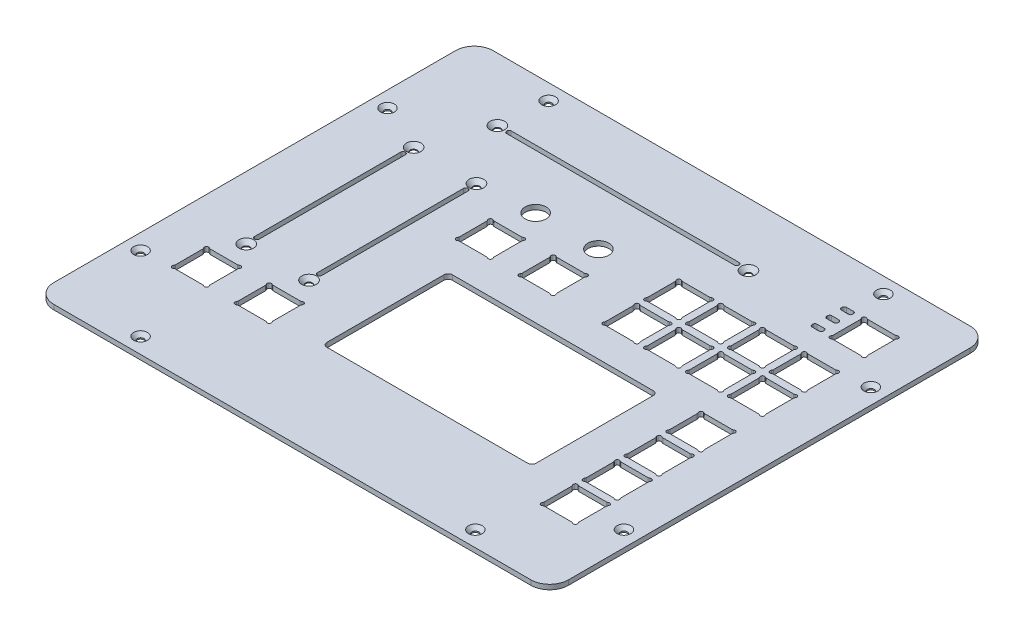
SolidWorks part; units mm, degrees
ref_plane "Alzado" through (0, 0, 0) normal (0, 0, 1) x (1, 0, 0)
ref_plane "Planta" through (0, 0, 0) normal (0, 1, 0) x (1, 0, 0)
ref_plane "Vista lateral" through (0, 0, 0) normal (1, 0, 0) x (0, 0, -1)
sketch "Croquis1" plane through (0, 0, 0) normal (0, 1, 0) x (1, 0, 0)
  line L0 (0, -1.1) -> (0, 1.1) construction
  line L1 (-55, 0) -> (55, 0) construction
  line L4 (125, -97) -> (125, 113)
  line L5 (125, -97) -> (-121, -97)
  line L6 (-121, -97) -> (-121, 113)
  line L7 (125, 113) -> (-121, 113)
  dimension "D1" = 210
  dimension "D2" = 246
  dimension "D4" = 125
  dimension "D8" = 113
extrude "Saliente-Extruir1" add sketch "Croquis1" along normal blind 2.3
sketch "Croquis5" plane through (0, 2.3, 0) normal (0, 1, 0) x (1, 0, 0)
  line L5 (125, 113) -> (-121, 113) construction
  line L6 (-121, 113) -> (-121, -97) construction
  line L7 (125, -97) -> (125, 113) construction
  line L8 (-121, -97) -> (125, -97) construction
  line L12 (109, 97) -> (-105, 97) construction
  line L13 (-105, 97) -> (-105, -81) construction
  line L14 (-105, -81) -> (109, -81) construction
  line L15 (109, -81) -> (109, 97) construction
  dimension "D1" = 16
  dimension "D2" = 16
  dimension "D3" = 16
  dimension "D4" = 16
fillet "Redondeo2" radius 9 4 edges at (125, 1.15, 97) (-121, 1.15, 97) (125, 1.15, -113) (-121, 1.15, -113)
sketch "Croquis3" plane through (0, 2.3, 0) normal (0, 1, 0) x (1, 0, 0)
  line L0 (-113.5, 8) -> (117.5, 8) construction
  line L1 (-110, 105.5) -> (-110, -89.5) construction
  line L2 (110, 105.5) -> (110, -89.5) construction
  line L3 (82, -89.5) -> (82, 105.5) construction
  line L4 (-121, 104) -> (-121, -88) construction
  line L5 (-78, 105.5) -> (-78, -89.5) construction
  line L7 (-110, -46.9118) -> (-78, -46.9118) construction
  line L8 (82, -46.9118) -> (110, -46.9118) construction
  line L9 (-112, -97) -> (116, -97) construction
  line L18 (0, 190.0033) -> (0, -241.867) construction
  line L23 (-113.5, 104) -> (-113.5, -88)
  line L24 (-112, -89.5) -> (116, -89.5)
  line L25 (117.5, -88) -> (117.5, 104)
  line L26 (116, 105.5) -> (-112, 105.5)
  line L27 (-113.5, 104) -> (-113.5, -88) construction
  line L28 (-112, -89.5) -> (116, -89.5) construction
  line L29 (117.5, -88) -> (117.5, 104) construction
  line L30 (116, 105.5) -> (-112, 105.5) construction
  circle A0 centre (-110, 105.5) radius 1.6 construction
  circle A1 centre (-78, 105.5) radius 1.6
  circle A2 centre (82, 105.5) radius 1.6
  circle A3 centre (110, 105.5) radius 1.6 construction
  circle A10 centre (117.5, 64) radius 1.6
  circle A11 centre (117.5, -54) radius 1.6
  circle A12 centre (-113.5, 64) radius 1.6
  circle A13 centre (-113.5, -54) radius 1.6
  arc A14 (116, -89.5) -> (117.5, -88) centre (116, -88) ccw
  arc A15 (116, -89.5) -> (117.5, -88) centre (116, -88) ccw construction
  arc A16 (117.5, 104) -> (116, 105.5) centre (116, 104) ccw
  arc A17 (117.5, 104) -> (116, 105.5) centre (116, 104) ccw construction
  arc A18 (-112, 105.5) -> (-113.5, 104) centre (-112, 104) ccw
  arc A19 (-112, 105.5) -> (-113.5, 104) centre (-112, 104) ccw construction
  arc A20 (-113.5, -88) -> (-112, -89.5) centre (-112, -88) ccw
  arc A21 (-113.5, -88) -> (-112, -89.5) centre (-112, -88) ccw construction
  circle A22 centre (-78, -89.5) radius 1.6
  circle A23 centre (82, -89.5) radius 1.6
  point P23 (0, 132.35)
  point P29 (0.4627, 121.1808)
  point P33 (-113.5, 8)
  point P54 (0, 132.35)
  dimension "D1" = 3.2
  dimension "D3" = 220
  dimension "D8" = 43
  dimension "D6" = 43
  dimension "D4" = 160
  dimension "D5" = 161
  dimension "D2" = 7.5
  dimension "D9" = 110
extrude "Cortar-Extruir1" cut sketch "Croquis3" against normal through all
chamfer "Chaflán1" distance 1.7 angle 45 8 edges at (-78, 2.3, 91.1) (117.5, 2.3, -62.4) (82, 2.3, -103.9) (-78, 2.3, -103.9) (117.5, 2.3, 55.6) (82, 2.3, 91.1) (-113.5, 2.3, 55.6) (-113.5, 2.3, -62.4)
sketch "Croquis6" plane through (0, 2.3, 0) normal (0, 1, 0) x (1, 0, 0)
  line L0 (-219.7186, 83) -> (49780.2814, 83) construction
  line L1 (116, 113) -> (-112, 113) construction
  line L2 (-75.5, 84.1) -> (35.5, 84.1)
  line L3 (-75.5, 84.1) -> (-75.5, 81.9)
  line L4 (-75.5, 81.9) -> (35.5, 81.9)
  line L5 (35.5, 84.1) -> (35.5, 81.9)
  line L7 (-91, 73.8475) -> (-91, -49926.1525) construction
  line L8 (-121, 104) -> (-121, -88) construction
  line L9 (-92.1, 50) -> (-89.9, 50)
  line L10 (-92.1, 50) -> (-92.1, -22)
  line L11 (-92.1, -22) -> (-89.9, -22)
  line L12 (-89.9, 50) -> (-89.9, -22)
  line L13 (116, 113) -> (-112, 113) construction
  line L14 (109, -81) -> (109, 97) construction
  circle A0 centre (40, 83) radius 1.6
  circle A1 centre (-80, 83) radius 1.6
  circle A2 centre (-91, -26) radius 1.6
  circle A3 centre (-91, 54) radius 1.6
  point P6 (-75.5, 83)
  point P22 (-91, -22)
  dimension "D4" = 3.2
  dimension "D5" = 120
  dimension "D9" = 3.2
  dimension "D14" = 69
  dimension "D1" = 2.2
  dimension "D2" = 30
  dimension "D3" = 111
  dimension "D6" = 4.5
  dimension "D7" = 2.2
  dimension "D8" = 72
  dimension "D10" = 80
  dimension "D11" = 4
  dimension "D12" = 30
  dimension "D13" = 59
extrude "Cortar-Extruir3" cut sketch "Croquis6" against normal through all
sketch "Croquis7" plane through (0, 2.3, 0) normal (0, 1, 0) x (1, 0, 0)
  line L0 (109, -81) -> (109, 97) construction
  line L13 (116, 113) -> (-112, 113) construction
  line L15 (-103.2, 83) -> (-144.8619, 83) construction
  line L16 (-91, 54) -> (-91, -26) construction
  line L17 (77.6, 81.8) -> (83, 81.8)
  line L18 (87, 91.3) -> (103.6, 91.3)
  line L19 (87, 91.3) -> (87, 74.7)
  line L20 (87, 74.7) -> (103.6, 74.7)
  line L21 (103.6, 91.3) -> (103.6, 74.7)
  line L22 (77.6, 91.2) -> (83, 91.2)
  line L23 (77.6, 91.2) -> (77.6, 88.8)
  line L24 (77.6, 88.8) -> (83, 88.8)
  line L25 (83, 91.2) -> (83, 88.8)
  line L26 (77.6, 77.2) -> (83, 77.2)
  line L27 (77.6, 77.2) -> (77.6, 74.8)
  line L28 (77.6, 74.8) -> (83, 74.8)
  line L29 (83, 77.2) -> (83, 74.8)
  line L30 (80.3, 91.2) -> (80.3, 74.8) construction
  line L31 (95.3, 91.3) -> (95.3, 74.7) construction
  line L32 (77.6, 81.8) -> (77.6, 84.2)
  line L33 (77.6, 84.2) -> (83, 84.2)
  line L34 (83, 81.8) -> (83, 84.2)
  line L35 (77.6, 81.8) -> (83, 84.2) construction
  line L36 (77.6, 84.2) -> (83, 81.8) construction
  point P2 (95.3, 83)
  point P3 (80.3, 83)
  point P8 (95.3, 83)
  point P38 (80.3, 83)
  dimension "D2" = 15
  dimension "D3" = 5.4
  dimension "D4" = 2.4
  dimension "D6" = 30
  dimension "D9" = 16.6
  dimension "D10" = 16.6
  dimension "D11" = 5.4
  dimension "D13" = 16.4
  dimension "D14" = 2.4
  dimension "D15" = 2.4
extrude "Cortar-Extruir4" cut sketch "Croquis7" against normal through all
sketch "Croquis27" plane through (0, 2.3, 0) normal (0, 1, 0) x (1, 0, 0)
  line L0 (87, 91.3) -> (87, 74.7) construction
  line L1 (87.6, 75.3) -> (103, 75.3) construction
  line L2 (87.6, 75.3) -> (87.6, 90.7) construction
  line L3 (87.6, 90.7) -> (103, 90.7) construction
  line L4 (103, 75.3) -> (103, 90.7) construction
  line L5 (87.6, 75.3) -> (103, 90.7) construction
  line L6 (87.6, 90.7) -> (103, 75.3) construction
  line L7 (103.6, 91.3) -> (87, 91.3) construction
  line L8 (103.6, 74.7) -> (103.6, 91.3) construction
  line L9 (87, 74.7) -> (103.6, 74.7) construction
  circle A0 centre (103, 90.7) radius 1
  circle A1 centre (87.6, 90.7) radius 1
  circle A2 centre (87.6, 75.3) radius 1
  circle A3 centre (103, 75.3) radius 1
  point P0 (95.3, 83)
  dimension "D5" = 2
  dimension "D1" = 0.6
  dimension "D2" = 0.6
  dimension "D3" = 0.6
  dimension "D4" = 0.6
extrude "Cortar-Extruir20" cut sketch "Croquis27" against normal through all
fillet "Redondeo6" radius 1 8 edges at (103.6, 1.15, -76.1) (102.2, 1.15, -74.7) (88.4, 1.15, -74.7) (87, 1.15, -76.1) (87, 1.15, -89.9) (88.4, 1.15, -91.3) (103.6, 1.15, -89.9) (102.2, 1.15, -91.3)
sketch "Croquis14" plane through (0, 2.3, 0) normal (0, 1, 0) x (1, 0, 0)
  line L1 (-121, 104) -> (-121, -88) construction
  line L2 (-49, -73.3) -> (77, -73.3) construction
  line L3 (-49, -73.3) -> (-49, 23) construction
  line L4 (-49, 23) -> (77, 23) construction
  line L5 (77, -73.3) -> (77, 23) construction
  line L6 (-49, -73.3) -> (77, 23) construction
  line L7 (-49, 23) -> (77, -73.3) construction
  line L9 (116, 113) -> (-112, 113) construction
  point P4 (14, -25.15)
  dimension "D1" = 96.3
  dimension "D2" = 126
  dimension "D3" = 90
  dimension "D4" = 72
sketch "Croquis10" plane through (0, 2.3, 0) normal (0, 1, 0) x (1, 0, 0)
  line L0 (-112, -97) -> (116, -97) construction
  line L1 (-31, 10.5) -> (69, 10.5)
  line L2 (-31, 10.5) -> (-31, -49.5)
  line L3 (-31, -49.5) -> (69, -49.5)
  line L4 (69, 10.5) -> (69, -49.5)
  line L6 (-31, 10.5) -> (69, -49.5) construction
  line L7 (125, -88) -> (125, 104) construction
  point P7 (14, -25.15)
  dimension "D1" = 60
  dimension "D2" = 100
  dimension "D3" = 47.5
  dimension "D4" = 56
extrude "Cortar-Extruir7" cut sketch "Croquis10" against normal through all
fillet "Redondeo3" radius 2 4 edges at (-31, 1.15, 49.5) (69, 1.15, 49.5) (69, 1.15, -10.5) (-31, 1.15, -10.5)
pattern_linear "MatrizL5" count 2 spacing 30 along (1, 0, 0) of "Cortar-Extruir3"
sketch "Croquis18" plane through (0, 2.3, 0) normal (0, 1, 0) x (1, 0, 0)
  line L1 (-43, 42.7) -> (-26.4, 42.7)
  line L2 (-43, 42.7) -> (-43, 26.1)
  line L3 (-43, 26.1) -> (-26.4, 26.1)
  line L4 (-26.4, 42.7) -> (-26.4, 26.1)
  line L5 (-43, 42.7) -> (-26.4, 26.1) construction
  line L6 (-43, 26.1) -> (-26.4, 42.7) construction
  line L8 (-112, -97) -> (116, -97) construction
  line L9 (125, -88) -> (125, 104) construction
  point P0 (-34.7, 34.4)
  dimension "D1" = 16.6
  dimension "D2" = 16.6
  dimension "D3" = 131.4
  dimension "D4" = 159.7
extrude "Cortar-Extruir14" cut sketch "Croquis18" against normal through all
sketch "Croquis28" plane through (0, 2.3, 0) normal (0, 1, 0) x (1, 0, 0)
  line L0 (-43, 42.7) -> (-43, 26.1) construction
  line L1 (-42.4, 26.7) -> (-27, 26.7) construction
  line L2 (-42.4, 26.7) -> (-42.4, 42.1) construction
  line L3 (-42.4, 42.1) -> (-27, 42.1) construction
  line L4 (-27, 26.7) -> (-27, 42.1) construction
  line L5 (-42.4, 26.7) -> (-27, 42.1) construction
  line L6 (-42.4, 42.1) -> (-27, 26.7) construction
  line L7 (-26.4, 42.7) -> (-43, 42.7) construction
  line L8 (-26.4, 26.1) -> (-26.4, 42.7) construction
  circle A0 centre (-27, 42.1) radius 1
  circle A1 centre (-27, 26.7) radius 1
  circle A2 centre (-42.4, 26.7) radius 1
  circle A3 centre (-42.4, 42.1) radius 1
  point P0 (-34.7, 34.4)
  dimension "D4" = 2
  dimension "D1" = 0.6
  dimension "D2" = 0.6
  dimension "D3" = 0.6
extrude "Cortar-Extruir21" cut sketch "Croquis28" against normal through all
fillet "Redondeo7" radius 1 8 edges at (-43, 1.15, -27.5) (-41.6, 1.15, -26.1) (-27.8, 1.15, -26.1) (-26.4, 1.15, -27.5) (-26.4, 1.15, -41.3) (-27.8, 1.15, -42.7) (-43, 1.15, -41.3) (-41.6, 1.15, -42.7)
pattern_linear "MatrizL9" count 2 spacing 30 along (1, 0, 0) of "Cortar-Extruir14", "Cortar-Extruir21", "Redondeo7"
sketch "Croquis19" plane through (0, 2.3, 0) normal (0, 1, 0) x (1, 0, 0)
  line L1 (27, 42.7) -> (43.6, 42.7)
  line L2 (27, 42.7) -> (27, 26.1)
  line L3 (27, 26.1) -> (43.6, 26.1)
  line L4 (43.6, 42.7) -> (43.6, 26.1)
  line L5 (27, 42.7) -> (43.6, 26.1) construction
  line L6 (27, 26.1) -> (43.6, 42.7) construction
  line L48 (27, 62.7) -> (27, 46.1)
  line L49 (27, 62.7) -> (43.6, 62.7)
  line L50 (43.6, 62.7) -> (43.6, 46.1)
  line L51 (27, 46.1) -> (43.6, 46.1)
  line L52 (67, 42.7) -> (67, 26.1)
  line L53 (67, 42.7) -> (83.6, 42.7)
  line L54 (83.6, 42.7) -> (83.6, 26.1)
  line L55 (67, 26.1) -> (83.6, 26.1)
  line L56 (87, 42.7) -> (87, 26.1)
  line L57 (87, 42.7) -> (103.6, 42.7)
  line L58 (103.6, 42.7) -> (103.6, 26.1)
  line L59 (87, 26.1) -> (103.6, 26.1)
  line L60 (47, 42.7) -> (47, 26.1)
  line L61 (47, 42.7) -> (63.6, 42.7)
  line L62 (63.6, 42.7) -> (63.6, 26.1)
  line L63 (47, 26.1) -> (63.6, 26.1)
  line L64 (107, 42.7) -> (107, 26.1)
  line L65 (107, 42.7) -> (123.6, 42.7)
  line L66 (123.6, 42.7) -> (123.6, 26.1)
  line L67 (107, 26.1) -> (123.6, 26.1)
  line L68 (127, 42.7) -> (127, 26.1)
  line L69 (127, 42.7) -> (143.6, 42.7)
  line L70 (143.6, 42.7) -> (143.6, 26.1)
  line L71 (127, 26.1) -> (143.6, 26.1)
  line L72 (47, 62.7) -> (47, 46.1)
  line L73 (47, 62.7) -> (63.6, 62.7)
  line L74 (63.6, 62.7) -> (63.6, 46.1)
  line L75 (47, 46.1) -> (63.6, 46.1)
  line L76 (67, 62.7) -> (67, 46.1)
  line L77 (67, 62.7) -> (83.6, 62.7)
  line L78 (83.6, 62.7) -> (83.6, 46.1)
  line L79 (67, 46.1) -> (83.6, 46.1)
  line L80 (87, 62.7) -> (87, 46.1)
  line L81 (87, 62.7) -> (103.6, 62.7)
  line L82 (103.6, 62.7) -> (103.6, 46.1)
  line L83 (87, 46.1) -> (103.6, 46.1)
  line L84 (107, 62.7) -> (107, 46.1)
  line L85 (107, 62.7) -> (123.6, 62.7)
  line L86 (123.6, 62.7) -> (123.6, 46.1)
  line L87 (107, 46.1) -> (123.6, 46.1)
  line L88 (127, 62.7) -> (127, 46.1)
  line L89 (127, 62.7) -> (143.6, 62.7)
  line L90 (143.6, 62.7) -> (143.6, 46.1)
  line L91 (127, 46.1) -> (143.6, 46.1)
  line L92 (-1037.413, 34.4) -> (48962.587, 34.4) construction
  line L93 (-13, 40.9) -> (-13, 27.9) construction
  point P0 (35.3, 34.4)
  point P13 (-13, 34.4)
  dimension "D1" = 16.6
  dimension "D2" = 16.6
  dimension "D4" = 13
  dimension "D5" = 6
  dimension "D6" = 2
extrude "Botóns" cut sketch "Croquis19" against normal through all
sketch "Croquis29" plane through (0, 2.3, 0) normal (0, 1, 0) x (1, 0, 0)
  line L0 (43.6, 42.7) -> (27, 42.7) construction
  line L1 (27.6, 26.7) -> (43, 26.7) construction
  line L2 (27.6, 26.7) -> (27.6, 42.1) construction
  line L3 (27.6, 42.1) -> (43, 42.1) construction
  line L4 (43, 26.7) -> (43, 42.1) construction
  line L5 (27.6, 26.7) -> (43, 42.1) construction
  line L6 (27.6, 42.1) -> (43, 26.7) construction
  line L7 (27, 42.7) -> (27, 26.1) construction
  line L8 (27, 26.1) -> (43.6, 26.1) construction
  line L9 (43.6, 26.1) -> (43.6, 42.7) construction
  line L10 (43.6, 62.7) -> (27, 62.7) construction
  line L11 (27.6, 46.7) -> (43, 46.7) construction
  line L12 (27.6, 46.7) -> (27.6, 62.1) construction
  line L13 (27.6, 62.1) -> (43, 62.1) construction
  line L14 (43, 46.7) -> (43, 62.1) construction
  line L15 (27.6, 46.7) -> (43, 62.1) construction
  line L16 (27.6, 62.1) -> (43, 46.7) construction
  line L17 (27, 62.7) -> (27, 46.1) construction
  line L18 (43.6, 46.1) -> (43.6, 62.7) construction
  line L19 (27, 46.1) -> (43.6, 46.1) construction
  circle A0 centre (27.6, 42.1) radius 1
  circle A1 centre (43, 42.1) radius 1
  circle A2 centre (43, 26.7) radius 1
  circle A3 centre (27.6, 26.7) radius 1
  circle A4 centre (27.6, 62.1) radius 1
  circle A5 centre (43, 62.1) radius 1
  circle A6 centre (43, 46.7) radius 1
  circle A7 centre (27.6, 46.7) radius 1
  point P0 (35.3, 34.4)
  point P17 (35.3, 54.4)
  dimension "D5" = 2
  dimension "D10" = 2
  dimension "D1" = 0.6
  dimension "D2" = 0.6
  dimension "D3" = 0.6
  dimension "D4" = 0.6
  dimension "D6" = 0.6
  dimension "D7" = 0.6
  dimension "D8" = 0.6
  dimension "D9" = 0.6
extrude "Cortar-Extruir22" cut sketch "Croquis29" against normal through all
fillet "Redondeo8" radius 1 16 edges at (28.4, 1.15, -46.1) (42.2, 1.15, -46.1) (43.6, 1.15, -47.5) (43.6, 1.15, -61.3) (42.2, 1.15, -62.7) (28.4, 1.15, -62.7) (27, 1.15, -61.3) (27, 1.15, -47.5) (27, 1.15, -27.5) (28.4, 1.15, -26.1) (42.2, 1.15, -26.1) (43.6, 1.15, -27.5) (43.6, 1.15, -41.3) (42.2, 1.15, -42.7) (27, 1.15, -41.3) (28.4, 1.15, -42.7)
pattern_linear "MatrizL15" count 4 spacing 20 along (1, 0, 0) of "Botóns", "Cortar-Extruir22", "Redondeo8"
sketch "Croquis25" plane through (0, 2.3, 0) normal (0, 1, 0) x (1, 0, 0)
  line L0 (-34.7, -965.3) -> (-34.7, 49034.7) construction
  line L1 (-41.7, 63) -> (-27.7, 63)
  line L2 (-41.7, 63) -> (-41.7, 49)
  line L3 (-41.7, 49) -> (-27.7, 49)
  line L4 (-27.7, 63) -> (-27.7, 49)
  line L5 (-41.7, 63) -> (-27.7, 49) construction
  line L6 (-41.7, 49) -> (-27.7, 63) construction
  line L7 (-11.7, 63) -> (2.3, 63)
  line L8 (-11.7, 63) -> (-11.7, 49)
  line L9 (-11.7, 49) -> (2.3, 49)
  line L10 (2.3, 63) -> (2.3, 49)
  line L11 (-11.7, 63) -> (2.3, 49) construction
  line L12 (-11.7, 49) -> (2.3, 63) construction
  line L13 (-28.2, 42.7) -> (-41.2, 42.7) construction
  line L14 (-4.7, -965.3) -> (-4.7, 49034.7) construction
  line L15 (1.8, 42.7) -> (-11.2, 42.7) construction
  line L16 (-1059.213, 56) -> (48940.787, 56) construction
  line L18 (-91, 75.5) -> (61, 75.5) construction
  line L19 (-91, 75.5) -> (-91, 89.5) construction
  line L20 (-91, 89.5) -> (61, 89.5) construction
  line L21 (61, 75.5) -> (61, 89.5) construction
  line L22 (-91, 75.5) -> (61, 89.5) construction
  line L23 (-91, 89.5) -> (61, 75.5) construction
  line L25 (-67.5, -37) -> (-53.5, -37)
  line L27 (-67.5, -37) -> (-67.5, 75)
  line L28 (-67.5, 75) -> (-53.5, 75)
  line L29 (-53.5, -37) -> (-53.5, 75)
  line L30 (-67.5, -37) -> (-53.5, 75) construction
  line L31 (-67.5, 75) -> (-53.5, -37) construction
  line L32 (-97.5, -37) -> (-83.5, -37)
  line L33 (-97.5, -37) -> (-97.5, 75)
  line L34 (-97.5, 75) -> (-83.5, 75)
  line L35 (-83.5, -37) -> (-83.5, 75)
  line L36 (-97.5, -37) -> (-83.5, 75) construction
  line L37 (-97.5, 75) -> (-83.5, -37) construction
  line L38 (-92.1, 50) -> (-92.1, -22) construction
  line L39 (-75.5, 81.9) -> (35.5, 81.9) construction
  line L40 (35.5, 81.9) -> (35.5, 84.1) construction
  circle A0 centre (-80, 83) radius 1.6 construction
  circle A1 centre (-91, 54) radius 1.6 construction
  point P0 (-34.7, 56)
  point P5 (-4.7, 56)
  point P15 (-34.7, 42.7)
  point P20 (-4.7, 42.7)
  point P21 (-15, 82.5)
  point P29 (-60.5, 19)
  point P32 (35.5, 83)
  point P38 (-20, 81.9)
  point P40 (-90.5, 19)
  point P53 (-92.1, 14)
  dimension "D3" = 20
  dimension "D8" = 6.5
  dimension "D1" = 14
  dimension "D2" = 14
  dimension "D4" = 152
  dimension "D5" = 6.5
  dimension "D6" = 14
  dimension "D7" = 112
  dimension "D9" = 61
  dimension "D10" = 30
  dimension "D11" = 81
sketch "Croquis23" plane through (0, 2.3, 0) normal (0, 1, 0) x (1, 0, 0)
  circle A0 centre (-34.7, 56) radius 5
  circle A1 centre (-4.7, 56) radius 5
  dimension "D1" = 10
extrude "Cortar-Extruir19" cut sketch "Croquis23" against normal through all
chamfer "Chaflán2" distance 1.9 angle 45 6 edges at (-61, 2.3, 27.6) (-91, 2.3, 27.6) (-61, 2.3, -52.4) (-91, 2.3, -52.4) (40, 2.3, -81.4) (-80, 2.3, -81.4)
sketch "Croquis20" plane through (0, 2.3, 0) normal (0, 1, 0) x (1, 0, 0)
  line L0 (-91, 54) -> (-91, -26) construction
  line L1 (-99.3, -53.3) -> (-82.7, -53.3)
  line L2 (-99.3, -53.3) -> (-99.3, -36.7)
  line L3 (-99.3, -36.7) -> (-82.7, -36.7)
  line L4 (-82.7, -53.3) -> (-82.7, -36.7)
  line L5 (-99.3, -53.3) -> (-82.7, -36.7) construction
  line L6 (-99.3, -36.7) -> (-82.7, -53.3) construction
  circle A0 centre (-91, 54) radius 1.6 construction
  point P0 (-91, -45)
  dimension "D1" = 16.6
  dimension "D2" = 16.6
  dimension "D3" = 19
extrude "Cortar-Extruir16" cut sketch "Croquis20" against normal through all
sketch "Croquis30" plane through (0, 2.3, 0) normal (0, 1, 0) x (1, 0, 0)
  line L0 (-99.3, -36.7) -> (-99.3, -53.3) construction
  line L1 (-98.7, -52.7) -> (-83.3, -52.7) construction
  line L2 (-98.7, -52.7) -> (-98.7, -37.3) construction
  line L3 (-98.7, -37.3) -> (-83.3, -37.3) construction
  line L4 (-83.3, -52.7) -> (-83.3, -37.3) construction
  line L5 (-98.7, -52.7) -> (-83.3, -37.3) construction
  line L6 (-98.7, -37.3) -> (-83.3, -52.7) construction
  line L7 (-82.7, -53.3) -> (-82.7, -36.7) construction
  line L8 (-82.7, -36.7) -> (-99.3, -36.7) construction
  line L9 (-99.3, -53.3) -> (-82.7, -53.3) construction
  circle A0 centre (-98.7, -37.3) radius 1
  circle A1 centre (-83.3, -37.3) radius 1
  circle A2 centre (-83.3, -52.7) radius 1
  circle A3 centre (-98.7, -52.7) radius 1
  point P0 (-91, -45)
  dimension "D5" = 2
  dimension "D1" = 0.6
  dimension "D2" = 0.6
  dimension "D3" = 0.6
  dimension "D4" = 0.6
extrude "Cortar-Extruir23" cut sketch "Croquis30" against normal through all
fillet "Redondeo9" radius 1 8 edges at (-84.1, 1.15, 53.3) (-97.9, 1.15, 53.3) (-82.7, 1.15, 51.9) (-82.7, 1.15, 38.1) (-84.1, 1.15, 36.7) (-99.3, 1.15, 51.9) (-99.3, 1.15, 38.1) (-97.9, 1.15, 36.7)
pattern_linear "MatrizL12" count 2 spacing 30 along (1, 0, 0) of "Cortar-Extruir16", "Cortar-Extruir23", "Redondeo9"
sketch "Croquis21" plane through (0, 2.3, 0) normal (0, 1, 0) x (1, 0, 0)
  point P0 (-113.5, -54)
  point P1 (-91, -26)
  point P3 (-61, -26)
  point P5 (-78, -89.5)
  point P9 (-34.7, 56)
  point P10 (-4.7, 56)
  point P11 (-91, 54)
  point P12 (-34.8, 34.35)
  point P13 (-61, 54)
  point P15 (-4.8, 34.35)
  point P17 (80.3, 90)
  point P18 (80.3, 83)
  point P19 (-80, 83)
  point P20 (80.3, 76)
  point P21 (40, 83)
  point P23 (82, -89.5)
  point P25 (117.5, -54)
  point P27 (117.5, 64)
  point P29 (82, 105.5)
  point P35 (-78, 105.5)
  point P37 (-113.5, 64)
  point P39 (95.3, 83)
  point P43 (95.3, 54.35)
  point P44 (75.3, 54.35)
  point P45 (55.3, 54.35)
  point P46 (35.3, 54.35)
  point P47 (95.3, 34.35)
  point P48 (75.3, 34.35)
  point P49 (55.3, 34.35)
  point P50 (35.3, 34.35)
  point P51 (-61, -45)
  point P52 (-91, -45)
sketch "Croquis24" plane through (0, 2.3, 0) normal (0, 1, 0) x (1, 0, 0)
  line L0 (95.3, 61.75) -> (95.3, -79.6868) construction
  line L1 (87, -3.3) -> (103.6, -3.3)
  line L2 (87, -3.3) -> (87, 13.3)
  line L3 (87, 13.3) -> (103.6, 13.3)
  line L4 (103.6, -3.3) -> (103.6, 13.3)
  line L5 (87, -3.3) -> (103.6, 13.3) construction
  line L6 (87, 13.3) -> (103.6, -3.3) construction
  line L7 (-112, -97) -> (116, -97) construction
  line L8 (101.8, 62.7) -> (88.8, 62.7) construction
  point P0 (95.3, 5)
  point P10 (95.3, 62.7)
  dimension "D1" = 16.6
  dimension "D2" = 102
extrude "Cortar-Extruir18" cut sketch "Croquis24" against normal through all
sketch "Croquis31" plane through (0, 2.3, 0) normal (0, 1, 0) x (1, 0, 0)
  line L0 (87, 13.3) -> (87, -3.3) construction
  line L1 (87.6, -2.7) -> (103, -2.7) construction
  line L2 (87.6, -2.7) -> (87.6, 12.7) construction
  line L3 (87.6, 12.7) -> (103, 12.7) construction
  line L4 (103, -2.7) -> (103, 12.7) construction
  line L5 (87.6, -2.7) -> (103, 12.7) construction
  line L6 (87.6, 12.7) -> (103, -2.7) construction
  line L7 (103.6, 13.3) -> (87, 13.3) construction
  line L8 (103.6, -3.3) -> (103.6, 13.3) construction
  line L9 (87, -3.3) -> (103.6, -3.3) construction
  circle A0 centre (87.6, 12.7) radius 1
  circle A1 centre (103, 12.7) radius 1
  circle A2 centre (103, -2.7) radius 1
  circle A3 centre (87.6, -2.7) radius 1
  point P0 (95.3, 5)
  dimension "D5" = 2
  dimension "D1" = 0.6
  dimension "D2" = 0.6
  dimension "D3" = 0.6
  dimension "D4" = 0.6
extrude "Cortar-Extruir24" cut sketch "Croquis31" against normal through all
fillet "Redondeo10" radius 1 8 edges at (87, 1.15, 1.9) (88.4, 1.15, 3.3) (103.6, 1.15, 1.9) (102.2, 1.15, 3.3) (103.6, 1.15, -11.9) (102.2, 1.15, -13.3) (87, 1.15, -11.9) (88.4, 1.15, -13.3)
pattern_linear "MatrizL16" count 4 spacing 20 along (0, 0, 1) of "Cortar-Extruir18", "Redondeo10", "Cortar-Extruir24"
fillet "Redondeo5" radius 1 24 edges at (-92.1, 1.15, 22) (-89.9, 1.15, 22) (-89.9, 1.15, -50) (-92.1, 1.15, -50) (-62.1, 1.15, -50) (-59.9, 1.15, -50) (-62.1, 1.15, 22) (-59.9, 1.15, 22) (83, 1.15, -88.8) (83, 1.15, -74.8) (83, 1.15, -91.2) (83, 1.15, -77.2) (77.6, 1.15, -77.2) (77.6, 1.15, -91.2) (77.6, 1.15, -74.8) (77.6, 1.15, -88.8) (35.5, 1.15, -81.9) (35.5, 1.15, -84.1) (-75.5, 1.15, -81.9) (-75.5, 1.15, -84.1) (77.6, 1.15, -84.2) (77.6, 1.15, -81.8) (83, 1.15, -81.8) (83, 1.15, -84.2)
sketch "Croquis26" plane through (0, 2.3, 2) normal (0, 1, 0) x (1, 0, 0)
  line L0 (-122.1546, -30) -> (-45, -30)
  line L2 (75, 78) -> (75, 115)
  line L4 (75, 115) -> (116, 115)
  line L5 (125, 106) -> (125, 85)
  line L7 (125, 85) -> (109, 85)
  line L8 (109, 85) -> (109, -30)
  line L9 (109, -30) -> (125, -30)
  line L10 (125, -30) -> (125, -65)
  line L12 (125, -65) -> (-122.1546, -65)
  line L14 (-122.1546, -65) -> (-122.1546, -30)
  line L15 (-45, -30) -> (-45, 78)
  line L16 (-45, 78) -> (75, 78)
  line L17 (125, -86) -> (125, 106) construction
  line L18 (116, 115) -> (-112, 115) construction
  arc A1 (125, 106) -> (116, 115) centre (116, 106) ccw
  arc A2 (125, 106) -> (116, 115) centre (116, 106) ccw construction
  point P19 (117, 85)
  dimension "D7" = 30
  dimension "D1" = 50
  dimension "D2" = 35
  dimension "D3" = 16
  dimension "D4" = 120
  dimension "D5" = 108
  dimension "D6" = 37
  dimension "D8" = 115
